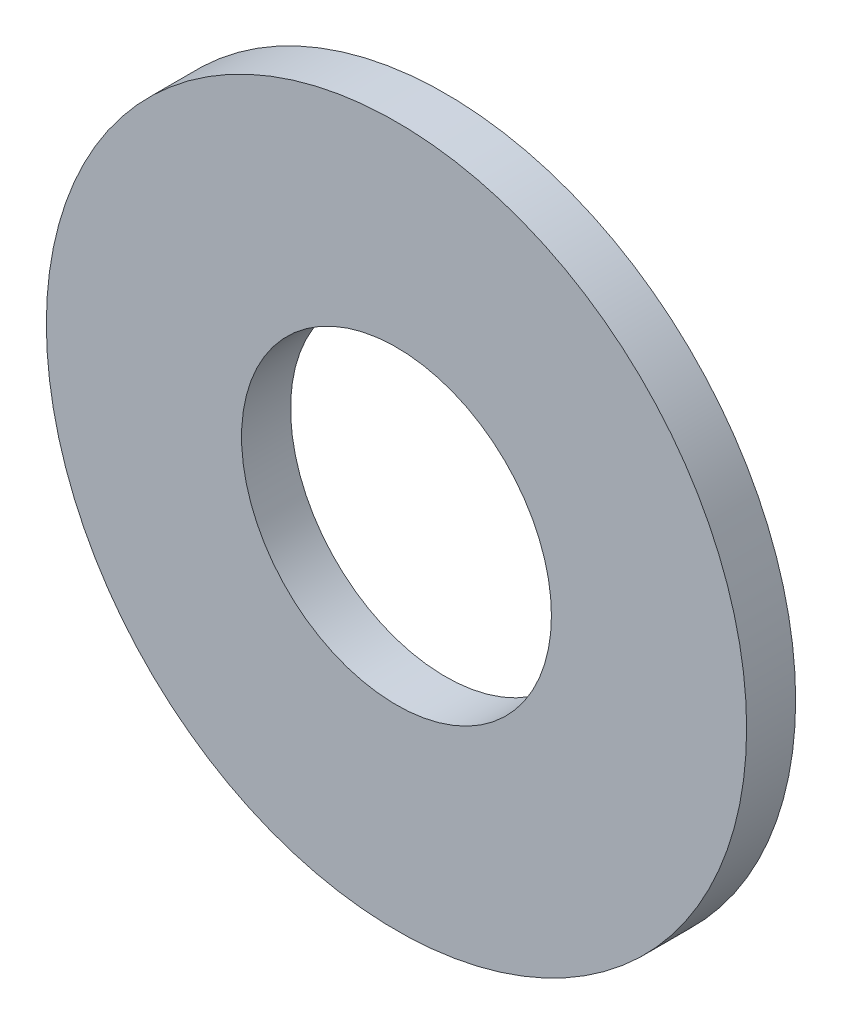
SolidWorks part; units mm, degrees
ref_plane "Front Plane" through (0, 0, 0) normal (0, 0, 1) x (1, 0, 0)
ref_plane "Top Plane" through (0, 0, 0) normal (0, 1, 0) x (1, 0, 0)
ref_plane "Right Plane" through (0, 0, 0) normal (1, 0, 0) x (0, 0, -1)
sketch "Sketch1" plane through (0, 0, 0) normal (0, 0, 1) x (1, 0, 0)
  circle A0 centre (0, 0) radius 5.6197
  circle A1 centre (0, 0) radius 12.7
extrude "Boss-Extrude1" add sketch "Sketch1" along normal blind 1.778
